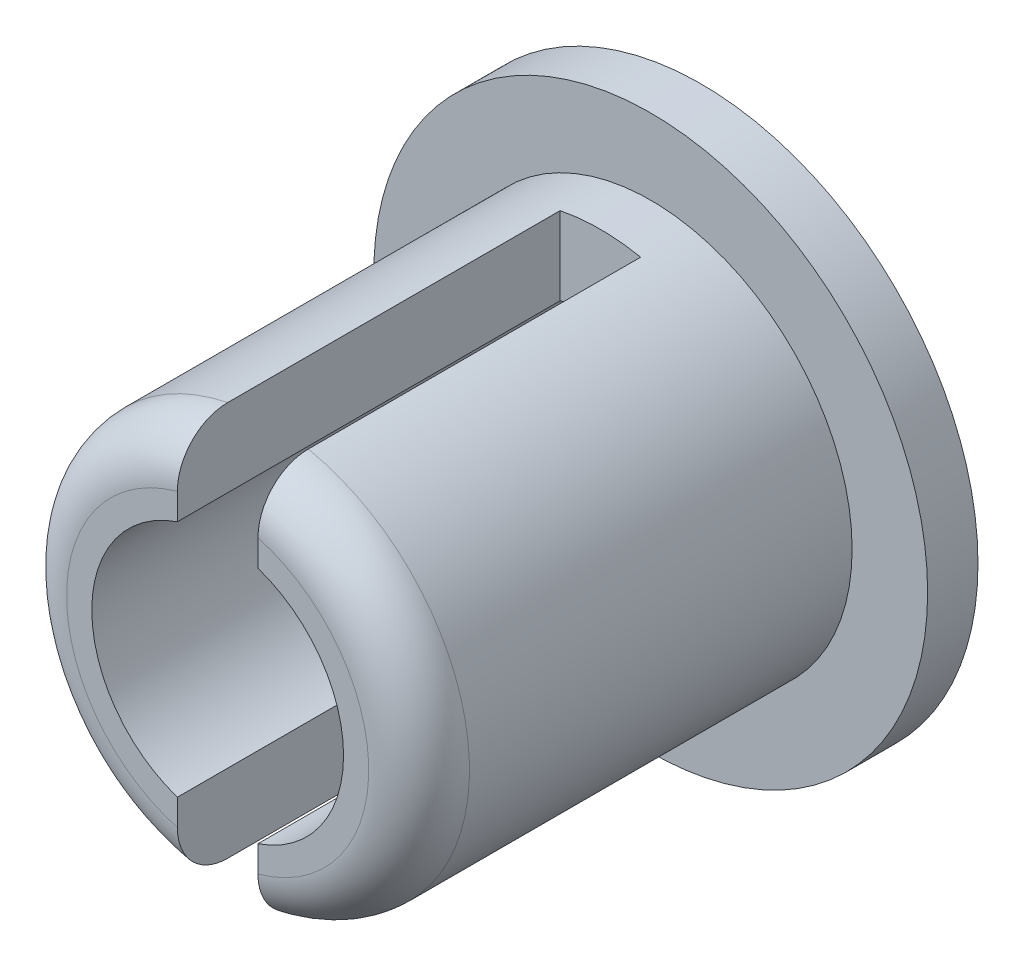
SolidWorks part; units mm, degrees
ref_plane "Plan de face" through (0, 0, 0) normal (0, 0, 1) x (1, 0, 0)
ref_plane "Plan de dessus" through (0, 0, 0) normal (0, 1, 0) x (1, 0, 0)
ref_plane "Plan de droite" through (0, 0, 0) normal (1, 0, 0) x (0, 0, -1)
sketch "Esquisse1" plane through (0, 0, 0) normal (0, 0, 1) x (1, 0, 0)
  circle A0 centre (0, 0) radius 2.75
  circle A1 centre (0, 0) radius 1.25
  dimension "D1" = 5.5
  dimension "D2" = 2.5
extrude "Boss.-Extru.1" add sketch "Esquisse1" along normal blind 0.5
sketch "Esquisse2" plane through (0, 0, 0.5) normal (0, 0, 1) x (1, 0, 0)
  circle A0 centre (0, 0) radius 2
  circle A1 centre (0, 0) radius 1.25 construction
  circle A2 centre (0, 0) radius 1.25
  dimension "D1" = 4
extrude "Boss.-Extru.2" add sketch "Esquisse2" along normal blind 0.5
sketch "Esquisse3" plane through (0, 0, 1) normal (0, 0, 1) x (1, 0, 0)
  line L1 (0.4, -2.7208) -> (-0.4, -2.7208)
  line L2 (0.4, -2.7208) -> (0.4, 2.7208)
  line L3 (0.4, 2.7208) -> (-0.4, 2.7208)
  line L4 (-0.4, -2.7208) -> (-0.4, 2.7208)
  line L5 (0.4, -2.7208) -> (-0.4, 2.7208) construction
  line L6 (0.4, 2.7208) -> (-0.4, -2.7208) construction
  circle A0 centre (0, 0) radius 2.75 construction
  circle A3 centre (0, 0) radius 2
  circle A4 centre (0, 0) radius 2
  point P0 (0, 0)
  dimension "D2" = 0
  dimension "D1" = 0.8
extrude "Boss.-Extru.3" add sketch "Esquisse3" along normal blind 3.8 contours L4 M3 M4 | L2 M3 M4
fillet "Congé1" radius 0.5 2 edges at (2, 0, 4.8) (-2, 0, 4.8)
